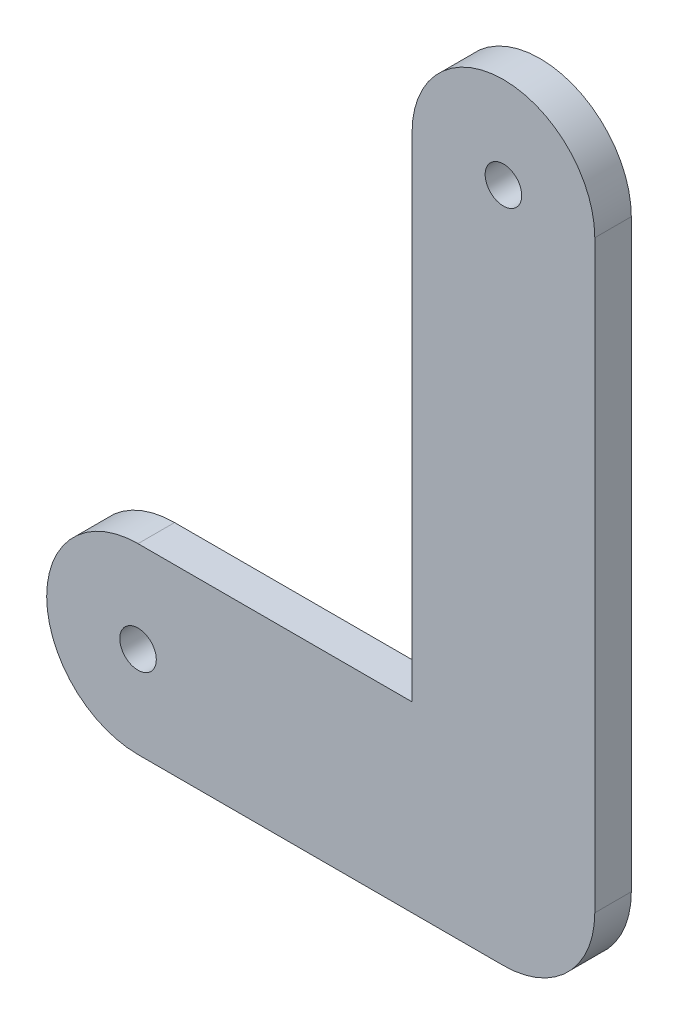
SolidWorks part; units mm, degrees
ref_plane "Plan de face" through (0, 0, 0) normal (0, 0, 1) x (1, 0, 0)
ref_plane "Plan de dessus" through (0, 0, 0) normal (0, 1, 0) x (1, 0, 0)
ref_plane "Plan de droite" through (0, 0, 0) normal (1, 0, 0) x (0, 0, -1)
sketch "Esquisse1" plane through (0, 0, 0) normal (0, 0, 1) x (1, 0, 0)
  line L0 (0, 0) -> (-100, 0) construction
  line L1 (0, -25) -> (-100, -25)
  line L2 (0, 25) -> (-100, 25)
  line L3 (0, 0) -> (0, 160) construction
  line L4 (-25, 0) -> (-25, 160)
  line L5 (25, 0) -> (25, 160)
  arc A0 (0, -25) -> (0, 25) centre (0, 0) ccw
  arc A1 (-100, 25) -> (-100, -25) centre (-100, 0) ccw
  arc A2 (-25, 0) -> (25, 0) centre (0, 0) ccw
  arc A3 (25, 160) -> (-25, 160) centre (0, 160) ccw
  point P3 (-50, 0)
  point P10 (0, 80)
  dimension "D1" = 100
  dimension "D2" = 50
  dimension "D3" = 50
  dimension "D4" = 160
extrude "Boss.-Extru.1" add sketch "Esquisse1" along normal blind 10 contours A2 L4 L2 A1 L1 | L4 A2 A0 L2 | L5 A3 L4 L2 A0
sketch "Esquisse2" plane through (0, 0, 10) normal (0, 0, 1) x (1, 0, 0)
  circle A0 centre (-100, 0) radius 5
  circle A1 centre (0, 160) radius 5
  dimension "D1" = 10
  dimension "D2" = 10
extrude "Enlèv. mat.-Extru.1" cut sketch "Esquisse2" against normal through all
